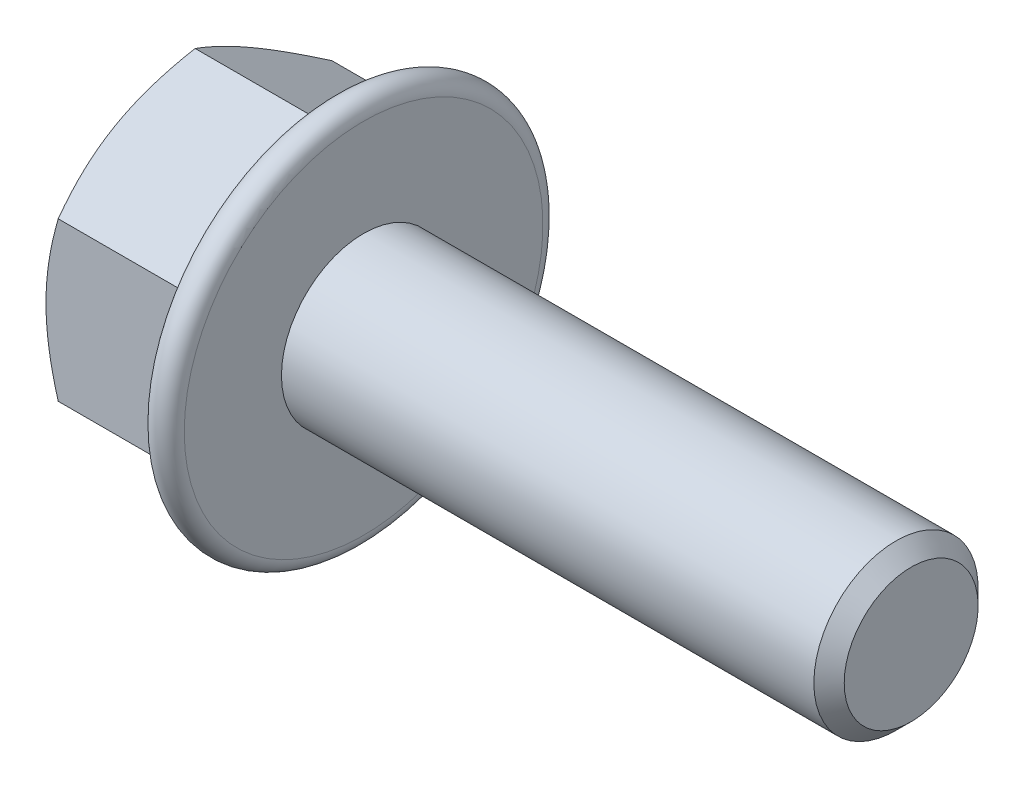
SolidWorks part; units mm, degrees
extrude "BaseHead" add sketch "Sketch1" along normal blind 6.6
sketch "Sketch1" plane through (0, 0, 0) normal (1, 0, 0) x (0, 0, -1)
  line L0 (5, 2.8868) -> (5, -2.8868)
  line L1 (-5, 2.8868) -> (-5, -2.8868)
  line L2 (5, -2.8868) -> (0, -5.7735)
  line L3 (0, -5.7735) -> (-5, -2.8868)
  line L4 (5, 2.8868) -> (0, 5.7735)
  line L5 (0, 5.7735) -> (-5, 2.8868)
ref_plane "Plane1" through (0, 0, 0) normal (0, 0, 1) x (1, 0, 0)
ref_plane "Plane2" through (0, 0, 0) normal (0, 1, 0) x (1, 0, 0)
ref_plane "Plane3" through (0, 0, 0) normal (1, 0, 0) x (0, 0, -1)
other "Configuration Table"
sketch "BodySke" plane through (0, 0, 0) normal (0, 0, 1) x (1, 0, 0)
  line L0 (0, 2.8868) -> (0, -2.8868) construction
  line L1 (0, 0) -> (26.6, 0)
  line L2 (0, 0) -> (0, 3)
  line L3 (0, 3) -> (26.0455, 3)
  line L4 (26.6, 0) -> (26.6, 2.4455)
  line L5 (6.6, 5.7735) -> (6.6, 2.8868) construction
  line L6 (26.6, 2.4455) -> (26.0455, 3)
  line L7 (0, 0) -> (96.52, 0) construction
  line L8 (26.6, -2.4455) -> (26.0455, -3) construction
  line L9 (0, -3) -> (26.0455, -3) construction
  line L10 (7.6, 15.24) -> (7.6, -1.27) construction
  line L11 (6.6, 15.24) -> (6.6, -1.27) construction
  line L12 (6.6, 2.8868) -> (6.6, -2.8868) construction
revolve "BaseBody" add sketch "BodySke"
fillet "HeadFillet" [suppressed] radius 0.25
sketch "Sketch3" plane through (0, 0, 0) normal (0, 0, 1) x (1, 0, 0)
  line L0 (0, 5) -> (3.3333, 10.7735)
  line L1 (0, 5.7735) -> (0, 2.8868) construction
  line L2 (3.3333, 10.7735) -> (3.3333, 15.7735)
  line L3 (3.3333, 15.7735) -> (-10, 15.7735)
  line L4 (-10, 15.7735) -> (-10, 5)
  line L5 (-10, 5) -> (0, 5)
  line L6 (0, 0) -> (99.06, 0) construction
  line L7 (6.6, 5.7735) -> (0, 5.7735) construction
revolve "HeadChamfer" cut sketch "Sketch3" angle 360 about L6
sketch "Sketch4" plane through (0, 0, 0) normal (0, 0, 1) x (1, 0, 0)
  line L0 (3.0807, 0) -> (5.5332, 6.7381)
  line L1 (6.6, 5.7735) -> (6.6, 2.8868) construction
  line L2 (5.5, 34.3444) -> (5.5, 16.9779) construction
  line L3 (6.6, 0) -> (6.6, 6.55)
  line L4 (8.3021, 7.1) -> (20.1618, 7.1) construction
  line L5 (0, 0) -> (95.25, 0) construction
  line L6 (0, 0) -> (96.52, 0) construction
  line L7 (3.0807, 0) -> (6.6, 0)
  line L8 (8.3021, -7.1) -> (20.1618, -7.1) construction
  arc A0 (6.6, 6.55) -> (5.5332, 6.7381) centre (6.05, 6.55) ccw
  dimension "D1" = 20
  dimension "Flange_thickness" = 1.1
  dimension "Flange_dia" = 14.2
revolve "Flange" add sketch "Sketch4" angle 360 about L5
fillet "FlangeHexFillet" radius 0.4 6 edges
sketch "ThdSchSke" plane through (0, 0, 0) normal (0, 0, 1) x (1, 0, 0)
  line L0 (7.6, -2.4455) -> (7.2117, -3)
  line L1 (7.6, -2.4455) -> (7.9883, -3)
  line L2 (7.9883, -3) -> (7.9883, -3.75)
  line L3 (-3.175, 0) -> (5.1513, 0) construction
  line L5 (7.9883, -3.75) -> (7.2117, -3.75)
  line L6 (7.2117, -3.75) -> (7.2117, -3)
revolve "ThreadSchematic" [suppressed] cut sketch "ThdSchSke" angle 360 about L3
pattern_linear "ThdSchPat" [suppressed]
equation "\"D3@Sketch1\" = \"Width_flats@Sketch1\" / 2"
equation "\"D4@Sketch1\" = \"D3@Sketch1\""
equation "\"D5@Sketch1\" = \"D4@Sketch1\""
equation "\"Thread_minor@ThreadCosmetic\" = \"Minor_dia@BodySke\""
equation "\"D1@Sketch3\" = \"Width_flats@Sketch1\" / 2"
equation "\"Thread_length@ThreadCosmetic\" = ((sgn( (\"Length@BodySke\" - \"Advance@BodySke\" ) - \"Thread_nom@BodySke\" )-1)*( (\"Length@BodySke\" - \"Advance@BodySke\" ) - \"Thread_nom@BodySke\" ))/-2+ \"Thread_nom@BodySke\""
equation "\"Thread_minor@ThdSchSke\" = \"Minor_dia@BodySke\""
equation "\"Diameter@ThdSchSke\" = \"Diameter@BodySke\""
equation "\"Overcut@ThdSchSke\" = \"Diameter@BodySke\" * 1.25"
equation "\"Start@ThdSchSke\" = \"Head_ht@BaseHead\" + \"Length@BodySke\" - \"Thread_length@ThreadCosmetic\"  '---Non-countersunk---"
equation "\"Num_threads@ThdSchPat\" = int( \"Thread_length@ThreadCosmetic\" / \"Advance@BodySke\" + 0.999 )  + 1"
equation "\"Advance@ThdSchPat\" = \"Thread_length@ThreadCosmetic\" /  (\"Num_threads@ThdSchPat\" - 1) 'relax it"
equation "\"Num_threads@ThdSchPat\" = \"Num_threads@ThdSchPat\" - sgn( \"Num_threads@ThdSchPat\" - 1) '---chamfered tips only---"
